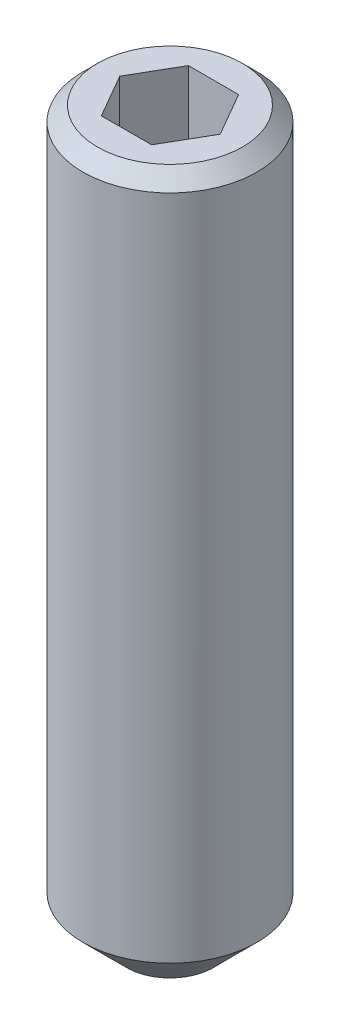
SolidWorks part; units mm, degrees
ref_plane "Plane1" through (0, 0, 0) normal (0, 0, 1) x (1, 0, 0)
ref_plane "Plane2" through (0, 0, 0) normal (0, 1, 0) x (1, 0, 0)
ref_plane "Plane3" through (0, 0, 0) normal (1, 0, 0) x (0, 0, -1)
sketch "Esquisse1" plane through (0, 0, 0) normal (0, 1, 0) x (1, 0, 0)
  circle A0 centre (0, 0) radius 3
  dimension "D1" = 6
extrude "Longueur filté" add sketch "Esquisse1" along normal blind 25
chamfer "Chanfrein1" distance 0.5 angle 45 1 edges at (0, 25, 3)
sketch "Esquisse6" plane through (0, 25, 0) normal (0, -1, 0) x (-1, 0, 0)
  line L1 (1.7321, 0) -> (0.866, 1.5)
  line L2 (0.866, 1.5) -> (-0.866, 1.5)
  line L3 (-0.866, 1.5) -> (-1.7321, 0)
  line L4 (-1.7321, 0) -> (-0.866, -1.5)
  line L5 (-0.866, -1.5) -> (0.866, -1.5)
  line L6 (0.866, -1.5) -> (1.7321, 0)
  circle A0 centre (0, 0) radius 1.5 construction
  dimension "S" = 3
extrude "Enlèv. mat.-Extru.4" cut sketch "Esquisse6" along normal blind 3.5
sketch "Esquisse9" plane through (0, 0, 0) normal (1, 0, 0) x (0, 0, -1)
  line L0 (0, 0) -> (0, 0.866)
  line L1 (0, 0.866) -> (-1.5, 0)
  line L3 (-1.5, 0) -> (0, 0)
  line L4 (0, 0) -> (0, 2.3876) construction
  dimension "D1" = 3
  dimension "D2" = 60
revolve "Enlèvement de matière-Révolution1" cut sketch "Esquisse9" angle 360 about L4
sketch "Esquisse11" plane through (0, 0, 0) normal (0, -1, 0) x (1, 0, 0)
  circle A0 centre (0, 0) radius 1.5 construction
  circle A1 centre (0, 0) radius 1.5
extrude "Enlèv. mat.-Extru.5" cut sketch "Esquisse11" against normal through all draft 45 flip side to cut
equation "\"Ch@Chanfrein1\" = (\"D1@Esquisse1\"-\"D2@Représentation de filetage1\")/2"
